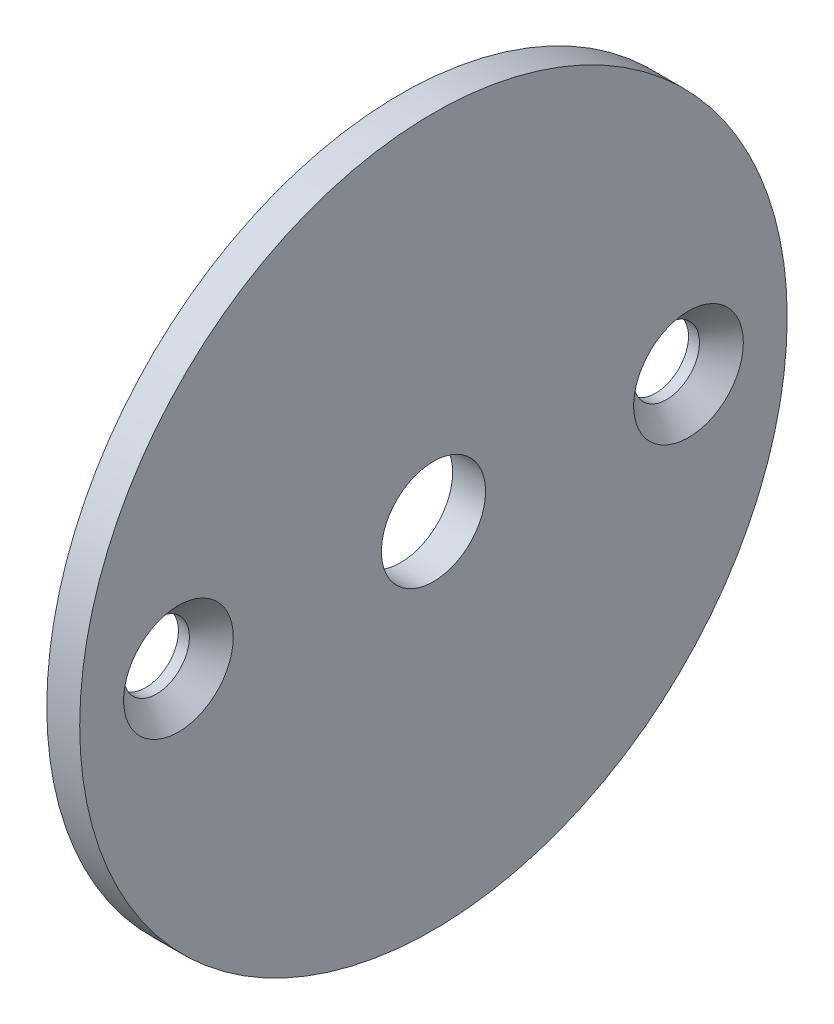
SolidWorks part; units mm, degrees
ref_plane "LAT. ESQUERDO" through (0, 0, 0) normal (0, 0, 1) x (1, 0, 0)
ref_plane "SUPERIOR" through (0, 0, 0) normal (0, 1, 0) x (1, 0, 0)
ref_plane "FRONTAL" through (0, 0, 0) normal (1, 0, 0) x (0, 0, -1)
sketch "Esboço1" plane through (0, 0, 0) normal (1, 0, 0) x (0, 0, -1)
  circle A0 centre (0, 0) radius 32.25
  circle A1 centre (0, 0) radius 4.75
  dimension "D1" = 64.5
  dimension "D2" = 9.5
sheet metal parameters "Chapa metálica1" thickness 3 parameters "D1"=0.1
base flange "Flange-base1" sketch "Esboço1" thickness 3 reverse thickness direction no parameters "D1"=0.1
hole_wizard "Furo de diâmetro Ø6.0 (6)1" positions "Esboço3" profile "Esboço2" hole size "Ø6.0" standard "Ansi Metric"
sketch "Esboço3" plane through (0, 0, 0) normal (1, 0, 0) x (0, 0, -1)
  line L0 (-23.25, 0) -> (23.25, 0) construction
  line L2 (-32.25, 0) -> (-23.25, 0) construction
  circle A0 centre (0, 0) radius 32.25 construction
  point P0 (-23.25, 0)
  point P2 (23.25, 0)
  dimension "D1" = 9
sketch "Esboço2" plane through (0, 0, 23.25) normal (0, 1, 0) x (0, 0, -1)
  line L0 (0, 0) -> (0, 3)
  line L1 (0, 3) -> (3, 3)
  line L2 (3, 3) -> (3, 0)
  line L5 (3, 0) -> (0, 0)
  line L11 (0, -6.35) -> (0, 107.95) construction
  dimension "Thru Hole Dia." = 6
  dimension "Thru Hole Depth" = 3
chamfer "Chanfro1" distance 2 angle 45 2 edges at (0, 0, -26.25) (0, 0, 20.25)
flat pattern "Padrão-Plano1"
sketch "Curva-Linhas1" plane through (0, 0, 0) normal (0, 1, 0) x (1, 0, 0)
sketch3d "Caixa delimitadora1" [suppressed]
  line L0 (32.1999, 32.3, 0) -> (32.2999, -32.2, 0) construction
  line L1 (-32.2999, 32.2, 0) -> (-32.1999, -32.3, 0) construction
  line L2 (32.1999, 32.3, 0) -> (-32.2999, 32.2, 0) construction
  line L3 (32.2999, -32.2, 0) -> (-32.1999, -32.3, 0) construction
